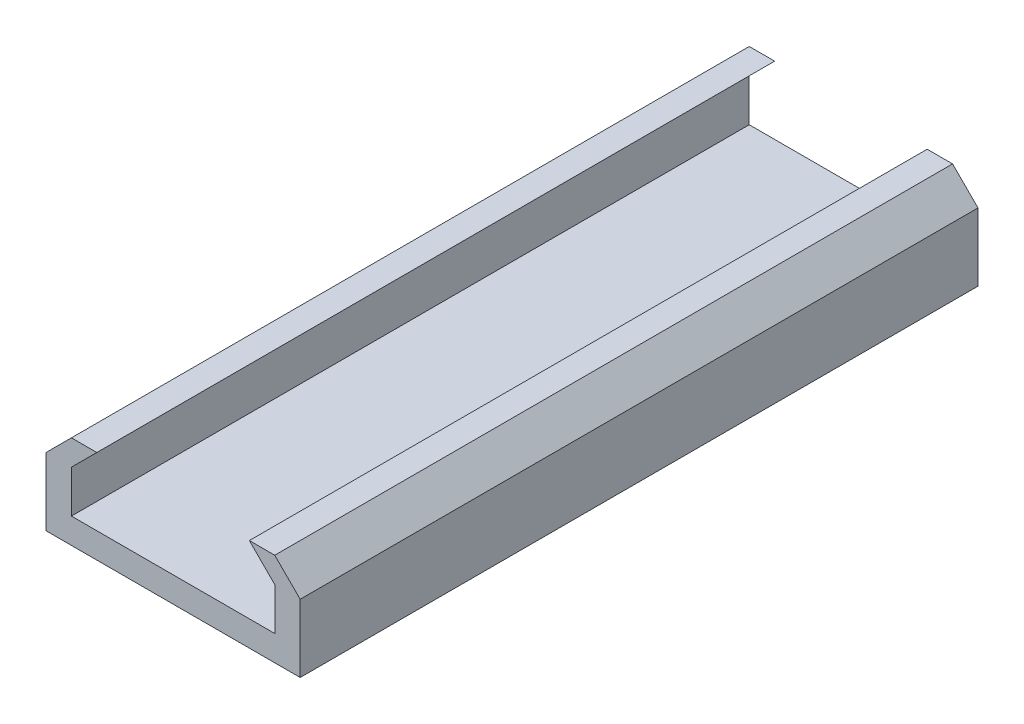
SolidWorks part; units mm, degrees
ref_plane "Front" through (0, 0, 0) normal (0, 0, 1) x (1, 0, 0)
ref_plane "Top" through (0, 0, 0) normal (0, 1, 0) x (1, 0, 0)
ref_plane "Right" through (0, 0, 0) normal (1, 0, 0) x (0, 0, -1)
sketch "Sketch1" plane through (0, 0, 0) normal (0, 0, 1) x (1, 0, 0)
  line L3 (-28.575, 25.4) -> (28.575, 25.4) construction
  line L6 (-47.625, 15.875) -> (-38.1, 25.4)
  line L7 (-47.625, -9.525) -> (-47.625, 15.875)
  line L8 (-47.625, -9.525) -> (47.625, -9.525)
  line L9 (47.625, -9.525) -> (47.625, 15.875)
  line L10 (38.1, 25.4) -> (47.625, 15.875)
  line L11 (-38.1, 25.4) -> (-28.575, 25.4)
  line L12 (28.575, 25.4) -> (38.1, 25.4)
  line L23 (38.1, 15.875) -> (28.575, 25.4)
  line L24 (38.1, 0) -> (38.1, 15.875)
  line L25 (-38.1, 0) -> (38.1, 0)
  line L26 (-38.1, 15.875) -> (-38.1, 0)
  line L27 (-28.575, 25.4) -> (-38.1, 15.875)
  dimension "D1" = 76.2
  dimension "D2" = 9.525
  dimension "D3" = 25.4
  dimension "D5" = 9.525
  dimension "D4" = 9.525
  dimension "D6" = 9.525
  dimension "D7" = 57.15
  dimension "D8" = 45
  dimension "D9" = 45
extrude "Base-Extrude" add sketch "Sketch1" against normal blind 254
